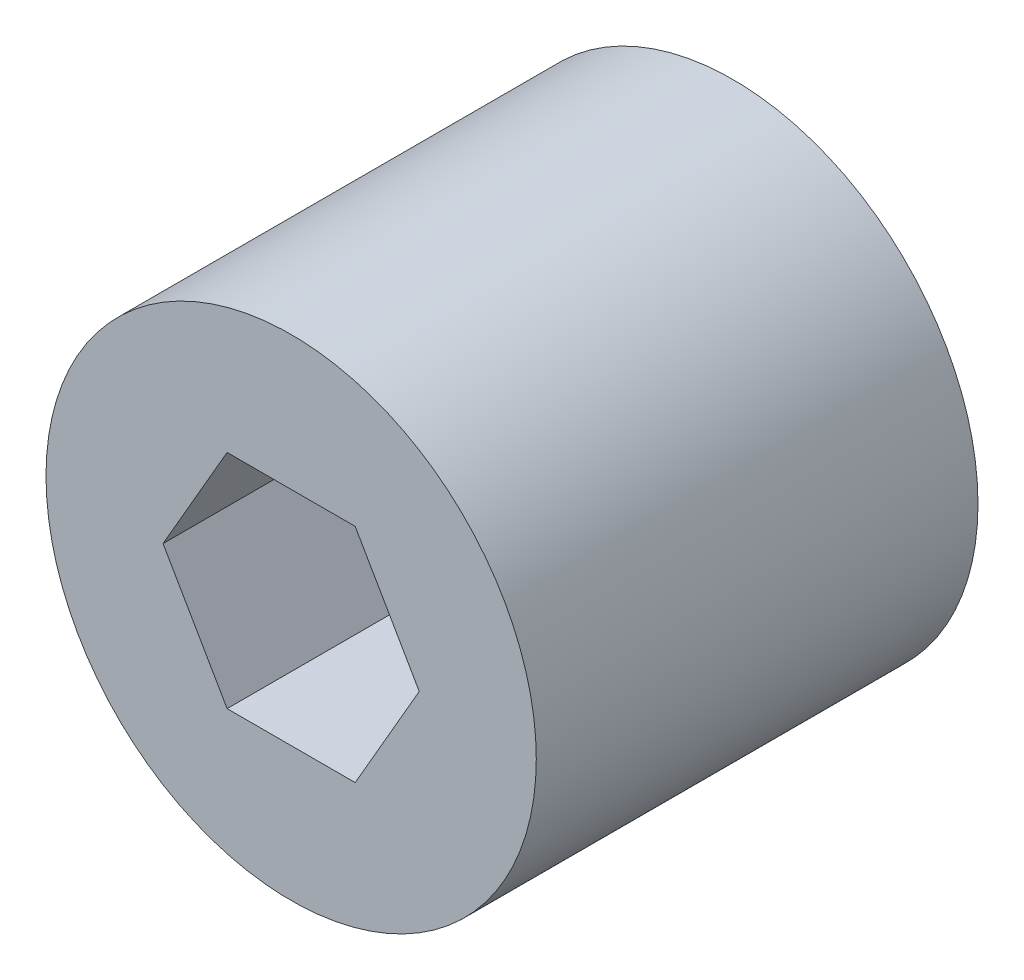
SolidWorks part; units mm, degrees
ref_plane "Front" through (0, 0, 0) normal (0, 0, 1) x (1, 0, 0)
ref_plane "Top" through (0, 0, 0) normal (0, 1, 0) x (1, 0, 0)
ref_plane "Right" through (0, 0, 0) normal (1, 0, 0) x (0, 0, -1)
sketch "Sketch1" plane through (0, 0, 0) normal (0, 0, 1) x (1, 0, 0)
  line L0 (0, 0) -> (7.366, 0) construction
  line L1 (0, 0) -> (3.683, -6.3791) construction
  line L2 (0, 0) -> (-3.683, -6.3791) construction
  line L3 (0, 0) -> (-7.366, 0) construction
  line L4 (0, 0) -> (-3.683, 6.3791) construction
  line L5 (0, 0) -> (3.683, 6.3791) construction
  line L6 (-3.683, 6.3791) -> (3.683, 6.3791)
  line L7 (3.683, 6.3791) -> (7.366, 0)
  line L8 (7.366, 0) -> (3.683, -6.3791)
  line L9 (3.683, -6.3791) -> (-3.683, -6.3791)
  line L10 (-3.683, -6.3791) -> (-7.366, 0)
  line L11 (-7.366, 0) -> (-3.683, 6.3791)
  circle A0 centre (0, 0) radius 14.097
  point P11 (0, 0)
  dimension "D1" = 28.194
  dimension "D2" = 7.366
extrude "Boss-Extrude1" add sketch "Sketch1" along normal blind 25.4
